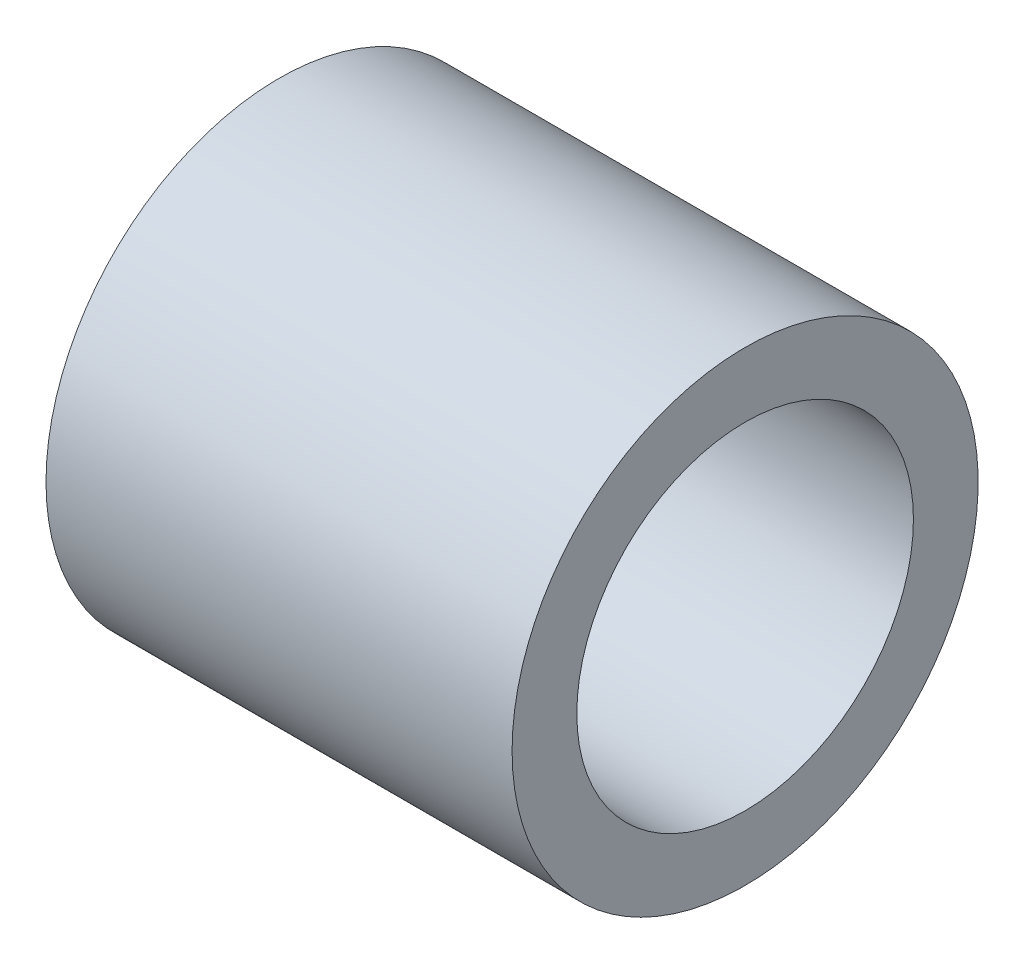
SolidWorks part; units mm, degrees
ref_plane "Front Plane" through (0, 0, 0) normal (0, 0, 1) x (1, 0, 0)
ref_plane "Top Plane" through (0, 0, 0) normal (0, 1, 0) x (1, 0, 0)
ref_plane "Right Plane" through (0, 0, 0) normal (1, 0, 0) x (0, 0, -1)
sketch "Sketch1" plane through (0, 0, 0) normal (0, 0, 1) x (1, 0, 0)
  line L0 (0, 0) -> (38.2599, 0) construction
  line L1 (0, 4.5) -> (9, 4.5)
  line L2 (9, 3.25) -> (9, 0)
  line L3 (0, 4.5) -> (0, 3.25)
  line L4 (0, 3.25) -> (9, 3.25) construction
  line L5 (9, 4.5) -> (9, 3.25)
  line L6 (9, 0) -> (0, 0)
  line L7 (0, 0) -> (0, 3.25)
  dimension "ID" = 6.5
  dimension "T" = 9
  dimension "OD" = 9
revolve "Revolve1" add sketch "Sketch1" angle 360 about L0
sketch "Sketch2" plane through (0, 0, 0) normal (0, 0, 1) x (1, 0, 0)
  line L0 (0, 3.25) -> (9, 3.25) construction
  line L1 (9, 3.25) -> (9, 0) construction
  line L2 (0, 0) -> (0, 3.25) construction
  line L3 (9, 0) -> (0, 0) construction
  line L4 (0, 3.25) -> (9, 3.25)
  line L5 (9, 3.25) -> (9, 0)
  line L6 (0, 0) -> (0, 3.25)
  line L7 (9, 0) -> (0, 0)
revolve "Cut-Revolve1" cut sketch "Sketch2" angle 360 about L0
sketch "Sketch3" plane through (0, 0, 0) normal (0, 0, 1) x (1, 0, 0)
  circle A0 centre (0, 0) radius 4.445
  dimension "D1" = 8.89
extrude "Extrude1" [suppressed] add sketch "Sketch3" along normal mid plane 6.35
